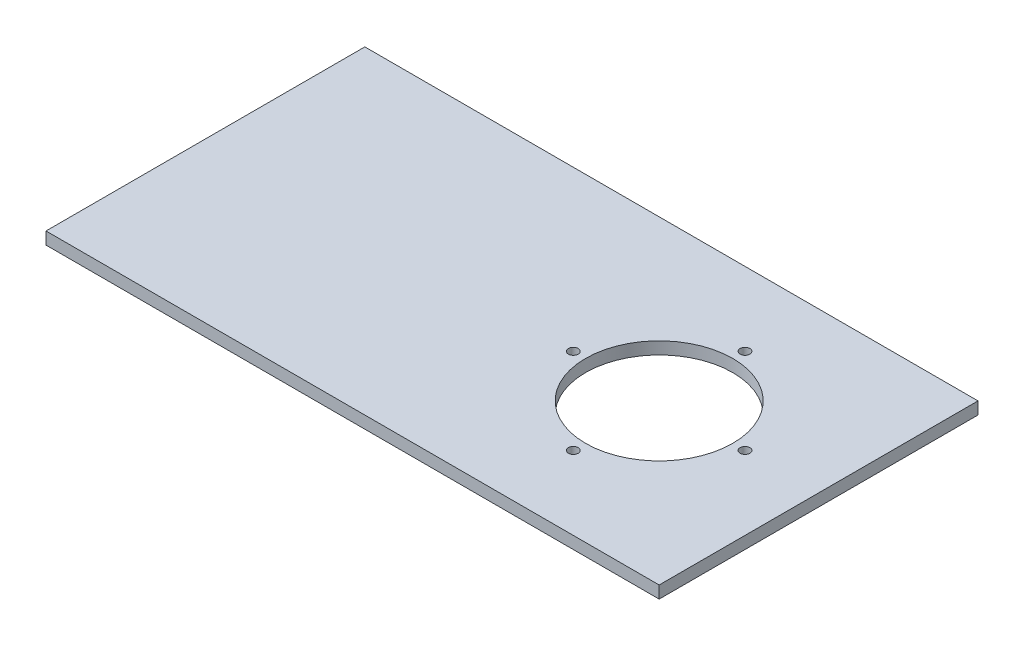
SolidWorks part; units mm, degrees
ref_plane "Front Plane" through (0, 0, 0) normal (0, 0, 1) x (1, 0, 0)
ref_plane "Top Plane" through (0, 0, 0) normal (0, 1, 0) x (1, 0, 0)
ref_plane "Right Plane" through (0, 0, 0) normal (1, 0, 0) x (0, 0, -1)
sketch "Sketch1" plane through (0, 0, 0) normal (0, 1, 0) x (1, 0, 0)
  line L1 (0, 0) -> (317.5, 0)
  line L2 (0, 0) -> (0, 165.1)
  line L3 (0, 165.1) -> (317.5, 165.1)
  line L4 (317.5, 0) -> (317.5, 165.1)
  dimension "D1" = 317.5
  dimension "D2" = 165.1
extrude "Boss-Extrude1" add sketch "Sketch1" along normal blind 6.35
sketch "Sketch2" plane through (0, 6.35, 0) normal (0, 1, 0) x (1, 0, 0)
  line L0 (317.5, 165.1) -> (0, 165.1) construction
  line L1 (317.5, 0) -> (317.5, 165.1) construction
  circle A0 centre (234.95, 82.55) radius 38.1
  dimension "D1" = 76.2
  dimension "D2" = 82.55
  dimension "D3" = 82.55
extrude "Cut-Extrude1" cut sketch "Sketch2" against normal blind 6.35
sketch "Sketch3" plane through (0, 6.35, 0) normal (0, 1, 0) x (1, 0, 0)
  line L0 (317.5, 165.1) -> (0, 165.1) construction
  line L1 (317.5, 0) -> (317.5, 165.1) construction
  circle A0 centre (234.95, 127) radius 2.54
  circle A1 centre (279.4, 82.55) radius 2.54
  circle A2 centre (234.95, 38.1) radius 2.54
  circle A3 centre (190.5, 82.55) radius 2.54
  point P15 (234.95, 82.55)
  dimension "D1" = 5.08
  dimension "D2" = 38.1
  dimension "D3" = 82.55
  dimension "D4" = 4
extrude "Cut-Extrude2" cut sketch "Sketch3" against normal blind 6.35
